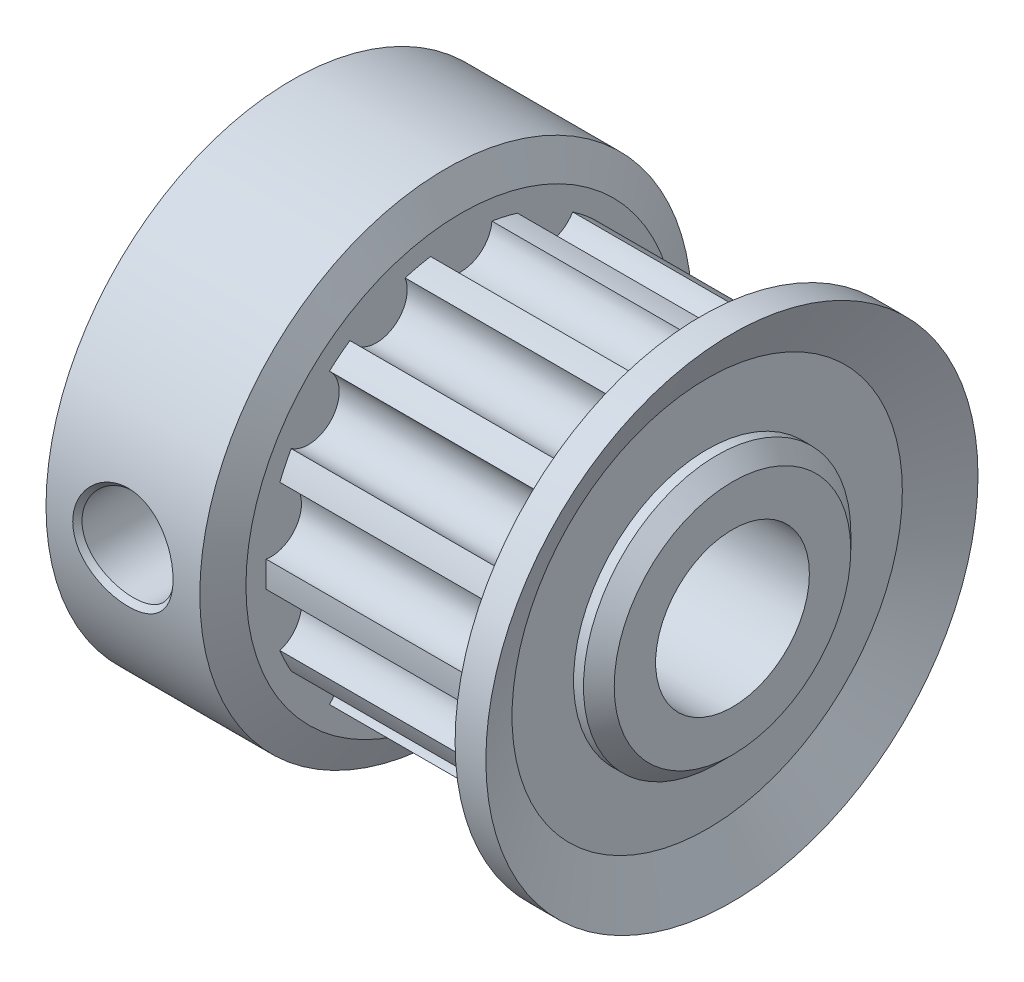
SolidWorks part; units mm, degrees
ref_plane "Plan de face" through (0, 0, 0) normal (0, 0, 1) x (1, 0, 0)
ref_plane "Plan de dessus" through (0, 0, 0) normal (0, 1, 0) x (1, 0, 0)
ref_plane "Plan de droite" through (0, 0, 0) normal (1, 0, 0) x (0, 0, -1)
sketch "Esquisse1" plane through (0, 0, 0) normal (0, 0, 1) x (1, 0, 0)
  line L0 (0, 4.6834) -> (0, 0) construction
  line L1 (0, 0) -> (14.8185, 0) construction
  line L2 (0, 0) -> (0, 3.3706)
  line L3 (0, 3.3706) -> (0.3, 3.6706)
  line L4 (0.3, 3.6706) -> (0.1, 3.6706)
  line L5 (0, 3.7706) -> (0, 7)
  line L6 (0, 7) -> (0.5, 8)
  line L7 (0.5, 8) -> (5.5, 8)
  line L8 (5.5, 8) -> (6, 7)
  line L9 (13.8, 8) -> (13, 6.3543)
  line L10 (13, 6.3543) -> (6, 6.3543)
  line L11 (6, 6.3543) -> (6, 7)
  line L12 (13.8, 8) -> (14.8, 8)
  line L13 (14.8, 8) -> (13.9956, 6.3452)
  line L14 (13.9956, 6.3452) -> (13.9956, 4.3452)
  line L15 (13.9956, 4.3452) -> (14.3185, 4.3452)
  line L16 (14.3185, 4.3452) -> (14.8185, 3.8452)
  line L17 (14.8185, 3.8452) -> (14.8185, 0)
  line L18 (14.8185, 0) -> (0, 0)
  arc A0 (0.1, 3.6706) -> (0, 3.7706) centre (0.1, 3.7706) cw
  point P15 (14.3, 8)
  point P19 (14.8185, 4.3452)
  point P23 (0, 3.6706)
  dimension "D11" = 0.1
  dimension "D1" = 14.8
  dimension "D2" = 0.5
  dimension "D3" = 7
  dimension "D4" = 1
  dimension "D5" = 2
  dimension "D6" = 0.5
  dimension "D7" = 5
  dimension "D8" = 8
  dimension "D9" = 0.3
  dimension "D10" = 0.3
  dimension "D12" = 1
  dimension "D13" = 1.84
revolve "Révolution1" add sketch "Esquisse1" angle 360 about L18
sketch "Esquisse2" plane through (14.8185, 0, 0) normal (1, 0, 0) x (0, 0, -1)
  circle A0 centre (0, 0) radius 2.5
  dimension "D1" = 5
extrude "Enlèv. mat.-Extru.1" cut sketch "Esquisse2" against normal through all
sketch "Esquisse3" plane through (6, 0, 0) normal (1, 0, 0) x (0, 0, -1)
  line L0 (0, 0) -> (0, 6.3543) construction
  circle A1 centre (0, 6.3543) radius 1
  circle A2 centre (2.757, 5.725) radius 1
  circle A3 centre (4.968, 3.9618) radius 1
  circle A4 centre (6.1949, 1.414) radius 1
  circle A5 centre (6.1949, -1.414) radius 1
  circle A6 centre (4.968, -3.9618) radius 1
  circle A7 centre (2.757, -5.725) radius 1
  circle A8 centre (0, -6.3543) radius 1
  circle A9 centre (-2.757, -5.725) radius 1
  circle A10 centre (-4.968, -3.9618) radius 1
  circle A11 centre (-6.1949, -1.414) radius 1
  circle A12 centre (-6.1949, 1.414) radius 1
  circle A13 centre (-4.968, 3.9618) radius 1
  circle A14 centre (-2.757, 5.725) radius 1
  circle A15 centre (0, 0) radius 6.3543 construction
  point P3 (0, 0)
  point P36 (0, 0)
  dimension "D1" = 2
  dimension "D2" = 14
extrude "Enlèv. mat.-Extru.2" cut sketch "Esquisse3" along normal blind 7
sketch "Esquisse4" plane through (0, 0, 0) normal (0, 0, 1) x (1, 0, 0)
  circle A0 centre (3, 0) radius 1.5
  dimension "D1" = 3
  dimension "D2" = 3
extrude "Enlèv. mat.-Extru.3" cut sketch "Esquisse4" along normal blind 17
chamfer "Chanfrein1" distance 0.2 angle 45 1 edges at (4.4664, -0.3156, 7.9938)
